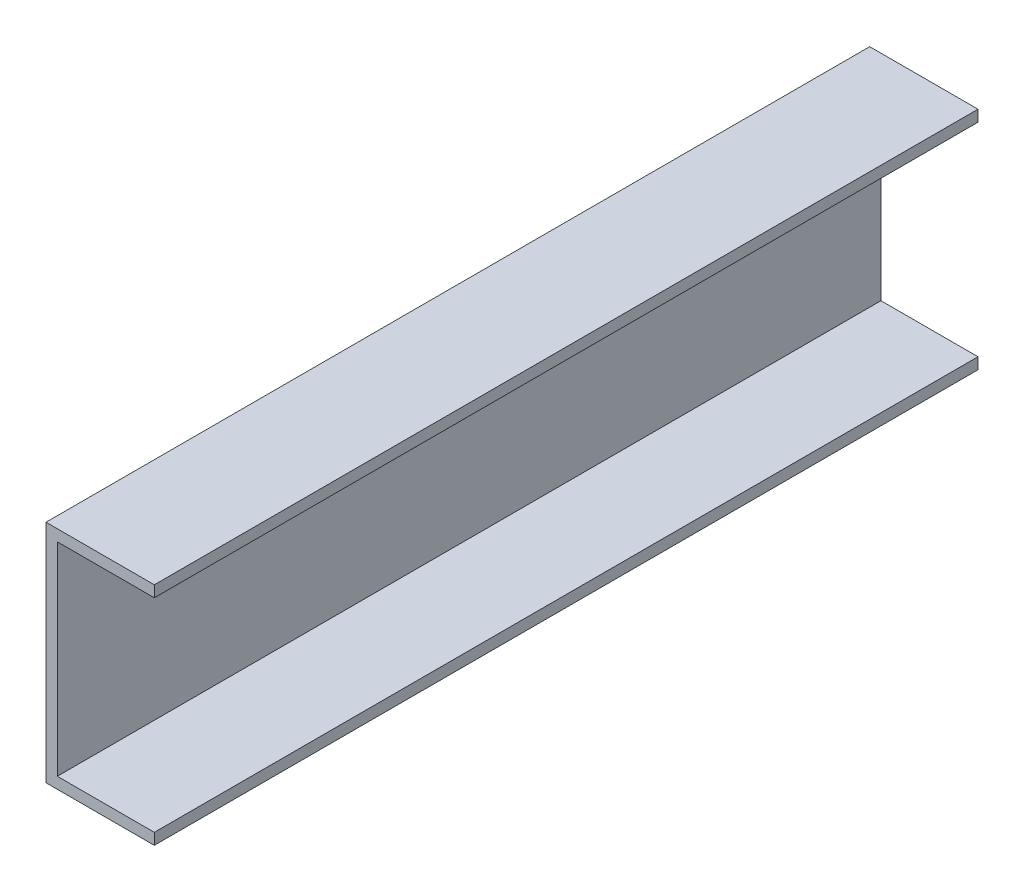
SolidWorks part; units mm, degrees
ref_plane "Front Plane" through (0, 0, 0) normal (0, 0, 1) x (1, 0, 0)
ref_plane "Top Plane" through (0, 0, 0) normal (0, 1, 0) x (1, 0, 0)
ref_plane "Right Plane" through (0, 0, 0) normal (1, 0, 0) x (0, 0, -1)
sketch "Sketch1" plane through (0, 0, 0) normal (0, 0, 1) x (1, 0, 0)
  line L0 (48, 0) -> (0, 0)
  line L1 (0, 0) -> (0, 100)
  line L2 (0, 100) -> (48, 100)
  line L3 (48, 100) -> (48, 95)
  line L4 (48, 95) -> (5, 95)
  line L5 (5, 95) -> (5, 5)
  line L6 (5, 5) -> (48, 5)
  line L7 (48, 5) -> (48, 0)
  dimension "D1" = 100
  dimension "D2" = 48
  dimension "D3" = 5
  dimension "D4" = 5
extrude "Boss-Extrude1" add sketch "Sketch1" along normal mid plane 365
